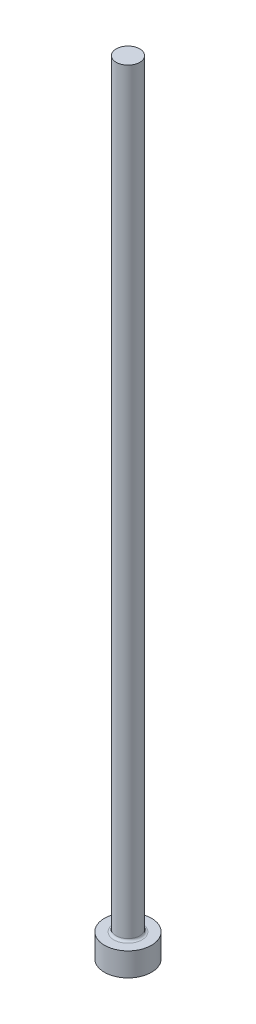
SolidWorks part; units mm, degrees
ref_plane "Plano frontal" through (0, 0, 0) normal (0, 0, 1) x (1, 0, 0)
ref_plane "Plano superior" through (0, 0, 0) normal (0, 1, 0) x (1, 0, 0)
ref_plane "Plano direito" through (0, 0, 0) normal (1, 0, 0) x (0, 0, -1)
sketch "Esboço1" plane through (0, 0, 0) normal (0, 0, 1) x (1, 0, 0)
  line L0 (0, 0) -> (3, 0)
  line L1 (3, 0) -> (3, 3)
  line L2 (3, 3) -> (1.8, 3)
  line L3 (1.5, 3.3) -> (1.5, 100)
  line L4 (1.5, 100) -> (0, 100)
  line L5 (0, 100) -> (0, 0) construction
  line L6 (0, 0) -> (0, 100)
  arc A0 (1.8, 3) -> (1.5, 3.3) centre (1.8, 3.3) cw
  dimension "D3" = 0.3
  dimension "D1" = 6
  dimension "D2" = 3
  dimension "D4" = 3
  dimension "D5" = 100
revolve "Revolução1" add sketch "Esboço1" angle 360 about L5
sketch "Esboço2"
  dimension "D1" = 1.6125
  dimension "D2" = 0.3375
  dimension "D3" = 0.525
  dimension "D4" = 0.225
wrap "Envolver1" sketch "Esboço2" wrap type deboss source sketch "Esboço2" thickness 0.1 parameters "D1"=0.1
